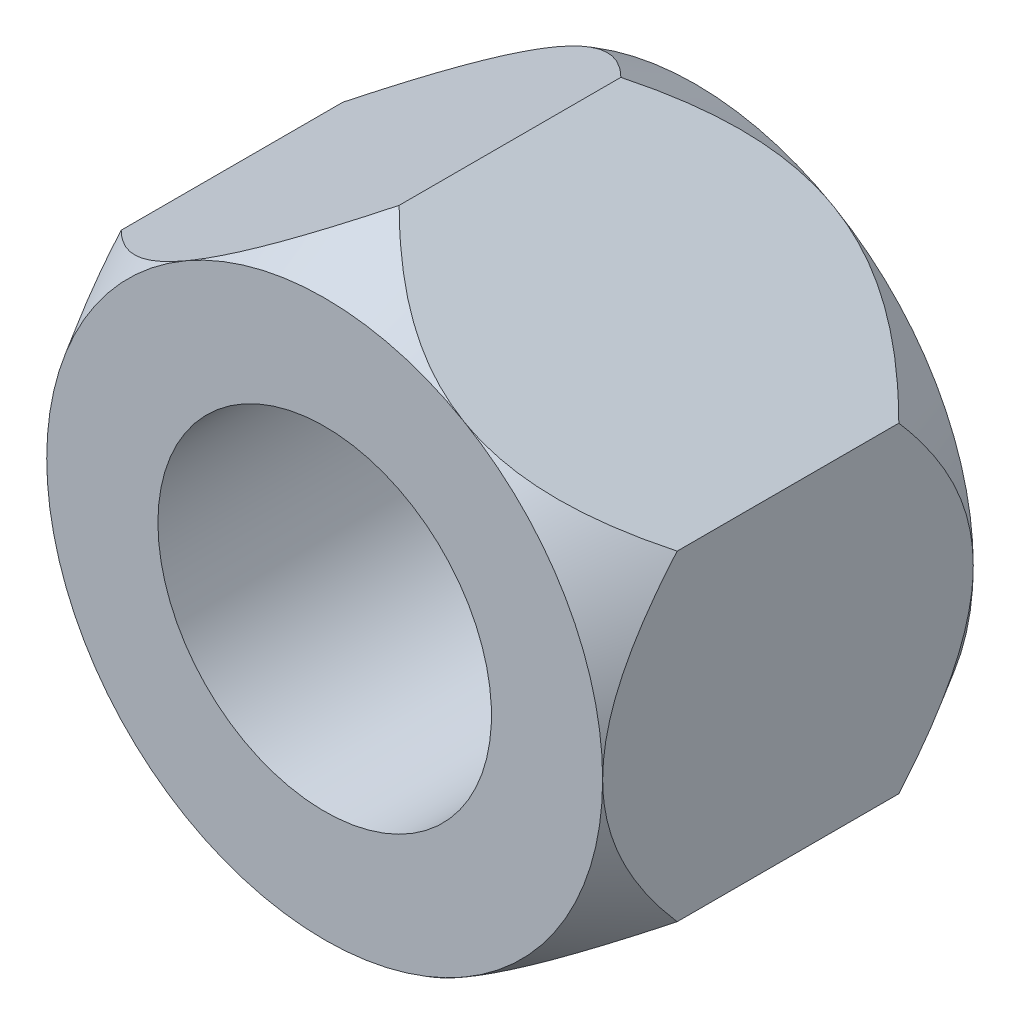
SolidWorks part; units mm, degrees
ref_plane "Front Plane" through (0, 0, 0) normal (0, 0, 1) x (1, 0, 0)
ref_plane "Top Plane" through (0, 0, 0) normal (0, 1, 0) x (1, 0, 0)
ref_plane "Right Plane" through (0, 0, 0) normal (1, 0, 0) x (0, 0, -1)
sketch "Sketch1" plane through (0, 0, 0) normal (0, 0, 1) x (1, 0, 0)
  line L1 (15, 8.6603) -> (0, 17.3205)
  line L2 (0, 17.3205) -> (-15, 8.6603)
  line L3 (-15, 8.6603) -> (-15, -8.6603)
  line L4 (-15, -8.6603) -> (0, -17.3205)
  line L5 (0, -17.3205) -> (15, -8.6603)
  line L6 (15, -8.6603) -> (15, 8.6603)
  circle A0 centre (0, 0) radius 15 construction
  dimension "D1" = 30
extrude "Boss-Extrude1" add sketch "Sketch1" along normal mid plane 20
ref_plane "Plane1" through (0, 0, 0) normal (-0.5, 0.866, 0) x (0, 0, 1)
ref_plane "Plane3" through (0, 0, 0) normal (0, 0, -1) x (-1, 0, 0)
sketch "Sketch4" plane through (0, 0, 0) normal (-0.5, 0.866, 0) x (0, 0, 1)
  line L1 (-5.9808, 17.3205) -> (-10, 17.3205)
  line L2 (-25.1503, 0) -> (21.6306, 0) construction
  line L3 (-10, 17.3205) -> (-10, 15)
  line L4 (5.9808, 17.3205) -> (10, 17.3205)
  line L5 (10, 17.3205) -> (10, 15)
  line L7 (-10, 15) -> (-5.9808, 17.3205)
  line L8 (5.9808, 17.3205) -> (10, 15)
  line L9 (10, 17.3205) -> (10, 8.6603) construction
  line L10 (-10, 17.3205) -> (-10, 8.6603) construction
  line L11 (10, 17.3205) -> (-10, 17.3205) construction
  dimension "D2" = 60
  dimension "D1" = 30
  dimension "D3" = 60
revolve "Cut-Revolve6" cut sketch "Sketch4" angle 360 about L2
hole_wizard "M20x2.0 Tapped Hole1" positions "Sketch8" profile "Sketch7" tap size "M20x2.0" standard "ISO"
sketch "Sketch8" plane through (0, 0, -10) normal (0, 0, -1) x (-1, 0, 0)
  point P0 (0, 0)
sketch "Sketch7" plane through (0, 0, -10) normal (1, 0, 0) x (0, 1, 0)
  line L0 (0, 0) -> (0, 20)
  line L1 (0, 20) -> (9, 20)
  line L2 (9, 20) -> (9, 0)
  line L5 (9, 0) -> (0, 0)
  line L11 (0, -6.35) -> (0, 107.95) construction
  dimension "Thread Major Dia." = 18
  dimension "Thru Tap Drill Depth" = 20
